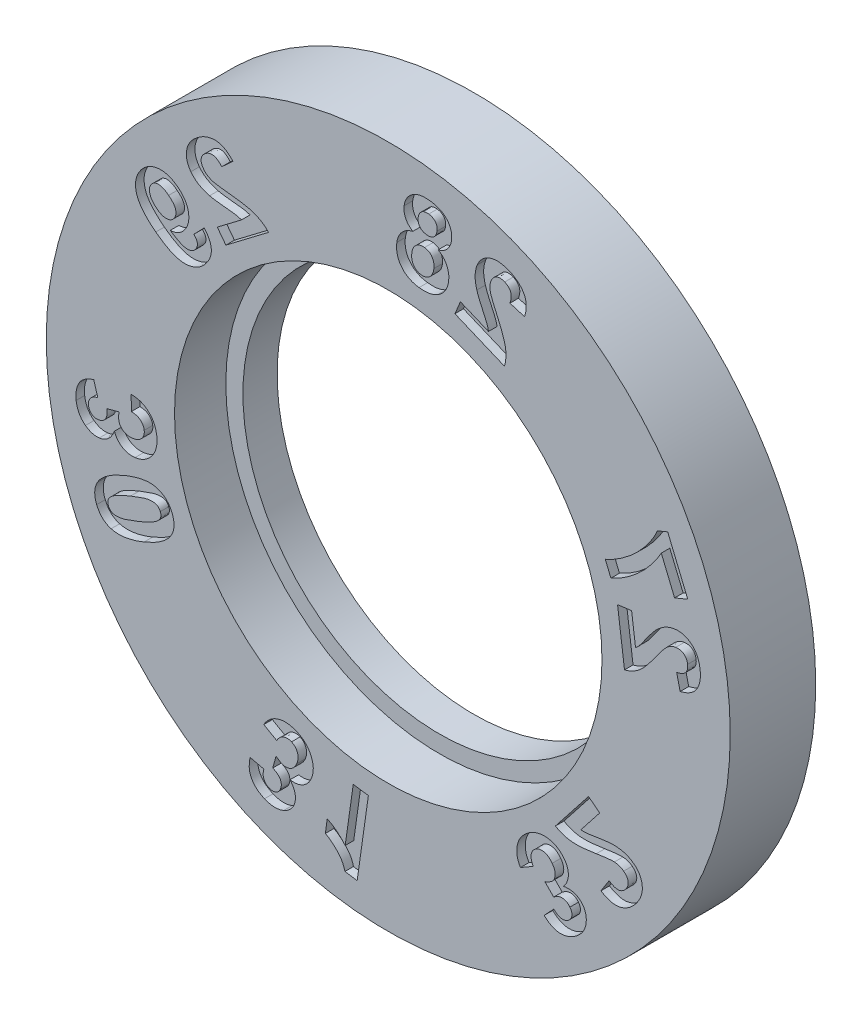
SolidWorks part; units mm, degrees
ref_plane "Front Plane" through (0, 0, 0) normal (0, 0, 1) x (1, 0, 0)
ref_plane "Top Plane" through (0, 0, 0) normal (0, 1, 0) x (1, 0, 0)
ref_plane "Right Plane" through (0, 0, 0) normal (1, 0, 0) x (0, 0, -1)
imported_body "Imported1"
other "DeleteFace2"
sketch "Sketch2" plane through (0, 0, 0) normal (0, 0, 1) x (1, 0, 0)
  line L2 (0, 0) -> (0, 21.375) construction
  line L3 (0, 0) -> (18.5113, 10.6875) construction
  line L4 (0, 0) -> (18.5113, -10.6875) construction
  line L5 (0, 0) -> (0, -21.375) construction
  line L6 (0, 0) -> (-18.5113, -10.6875) construction
  line L7 (0, 0) -> (-18.5113, 10.6875) construction
  circle A0 centre (0, 0) radius 13.8372 construction
  text T0 "27    28    29    30    31    32" font "Arial" height 4.7
  point P11 (0, 0)
  dimension "D1" = 6
extrude "Cut-Extrude1" cut sketch "Sketch2" against normal blind 0.5
